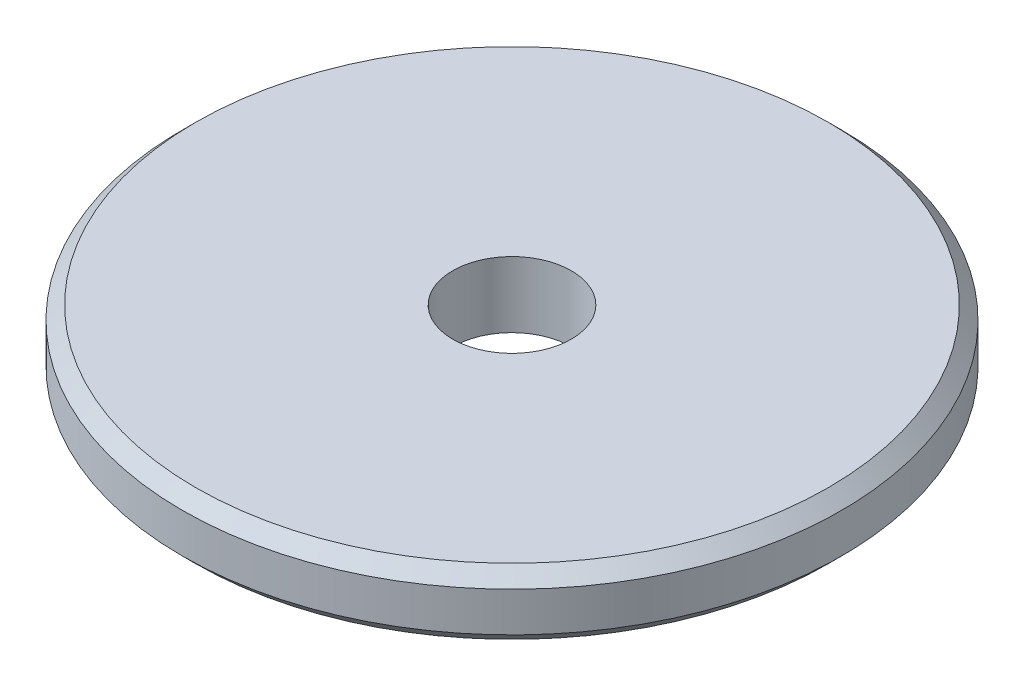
SolidWorks part; units mm, degrees
ref_plane "Front Plane" through (0, 0, 0) normal (0, 0, 1) x (1, 0, 0)
ref_plane "Top Plane" through (0, 0, 0) normal (0, 1, 0) x (1, 0, 0)
ref_plane "Right Plane" through (0, 0, 0) normal (1, 0, 0) x (0, 0, -1)
sketch "Sketch1" plane through (0, 0, 0) normal (0, 1, 0) x (1, 0, 0)
  circle A0 centre (0, 0) radius 25
  circle A1 centre (0, 0) radius 4.5
  dimension "D1" = 9
  dimension "D2" = 50
extrude "Extrude1" add sketch "Sketch1" along normal blind 5
chamfer "Chamfer1" distance 1 angle 45 2 edges at (0, 0, 25) (0, 5, 25)
